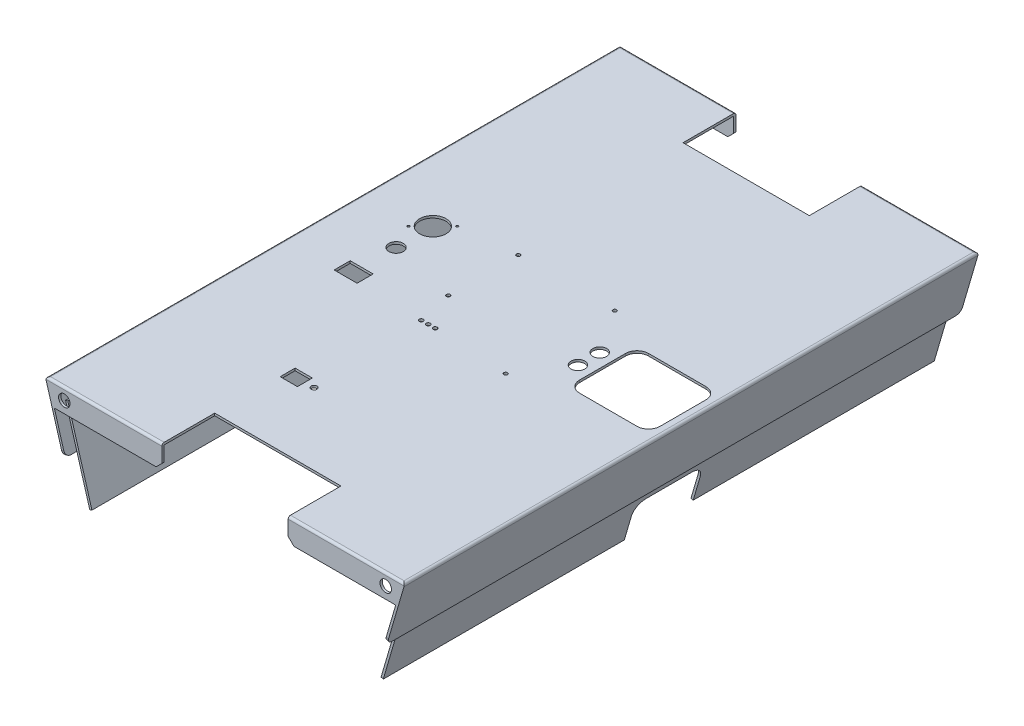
SolidWorks part; units mm, degrees
ref_plane "Plan de face" through (0, 0, 0) normal (0, 0, 1) x (1, 0, 0)
ref_plane "Plan de dessus" through (0, 0, 0) normal (0, 1, 0) x (1, 0, 0)
ref_plane "Plan de droite" through (0, 0, 0) normal (1, 0, 0) x (0, 0, -1)
sketch "Esquisse1" plane through (0, 0, 0) normal (0, 0, 1) x (1, 0, 0)
  line L0 (0, 0) -> (0, 51.9204) construction
  line L1 (-153.9518, 0) -> (153.9518, 0)
  line L2 (155.8714, -2.5612) -> (141, -53.432)
  line L3 (141, -53.432) -> (139.0803, -52.8708)
  line L4 (139.0803, -52.8708) -> (153.9518, -2)
  line L5 (153.9518, -2) -> (-153.9518, -2)
  line L6 (153.9518, 0) -> (175.1069, 0) construction
  line L7 (139.0803, -52.8708) -> (120, -118.139) construction
  line L8 (-139.0803, -52.8708) -> (-153.9518, -2)
  line L9 (-141, -53.432) -> (-139.0803, -52.8708)
  line L10 (-155.8714, -2.5612) -> (-141, -53.432)
  line L11 (155.8714, -2.5612) -> (162.0788, 18.6723) construction
  arc A0 (153.9518, 0) -> (155.8714, -2.5612) centre (153.9518, -2) cw
  arc A1 (-153.9518, 0) -> (-155.8714, -2.5612) centre (-153.9518, -2) ccw
  point P11 (153.7159, -11.4567)
  dimension "D1" = 53
  dimension "D2" = 2
  dimension "D3" = 141
  dimension "D4" = 68
  dimension "D5" = 120
extrude "Extrusion1" add sketch "Esquisse1" along normal blind 500
fillet "Congé1" radius 5 4 edges at (140.0402, -53.1514, 0) (-140.0402, -53.1514, 500) (140.0402, -53.1514, 500) (-140.0402, -53.1514, 0)
sketch "Esquisse2" plane through (-142.3694, -41.6199, 0) normal (0.9598, 0.2806, 0) x (0, 0, -1)
  line L1 (-490, 23.2782) -> (-10, 23.2782)
  line L2 (-490, 23.2782) -> (-490, -51.7218)
  line L3 (-490, -51.7218) -> (-280, -51.7218)
  line L4 (-10, 23.2782) -> (-10, -51.7218)
  line L5 (-250, 43.1978) -> (-250, -160.9671) construction
  line L6 (-500, 43.1978) -> (0, 43.1978) construction
  line L8 (-280, -51.7218) -> (-280, -29.7218)
  line L9 (-270, -19.7218) -> (-230, -19.7218)
  line L10 (-220, -29.7218) -> (-220, -51.7218)
  line L11 (-220, -51.7218) -> (-10, -51.7218)
  line L12 (-495, -11.7218) -> (-5, -11.7218) construction
  arc A0 (-280, -29.7218) -> (-270, -19.7218) centre (-270, -29.7218) cw
  arc A1 (-230, -19.7218) -> (-220, -29.7218) centre (-230, -29.7218) cw
  point P16 (-280, -19.7218)
  point P19 (-220, -19.7218)
  dimension "D6" = 10
  dimension "D1" = 480
  dimension "D2" = 75
  dimension "D3" = 35
  dimension "D4" = 60
  dimension "D5" = 32
extrude "Extrusion2" add sketch "Esquisse2" along normal blind 2
mirror "Symétrie1" about plane through (0, 0, 0) normal (1, 0, 0) of "Extrusion2"
sketch "Esquisse3" plane through (0, 0, 0) normal (0, 1, 0) x (-1, 0, 0)
  line L0 (-153.9518, 250) -> (-67.0313, 250) construction
  line L1 (-153.9518, 500) -> (-153.9518, 0) construction
  line L2 (-155.9518, 500) -> (-155.9518, 0) construction
  line L3 (-138.9518, 220) -> (-88.9518, 220)
  line L4 (-148.9518, 230) -> (-148.9518, 270)
  line L5 (-138.9518, 280) -> (-88.9518, 280)
  line L6 (-78.9518, 230) -> (-78.9518, 270)
  arc A0 (-138.9518, 220) -> (-148.9518, 230) centre (-138.9518, 230) cw
  arc A1 (-88.9518, 220) -> (-78.9518, 230) centre (-88.9518, 230) ccw
  arc A2 (-88.9518, 280) -> (-78.9518, 270) centre (-88.9518, 270) cw
  arc A3 (-148.9518, 270) -> (-138.9518, 280) centre (-138.9518, 270) cw
  dimension "D4" = 10
  dimension "D1" = 60
  dimension "D2" = 70
  dimension "D3" = 7
extrude "Enlèv. mat.-Extru.1" cut sketch "Esquisse3" against normal blind 2
sketch "Esquisse4" plane through (0, 0, 0) normal (0, 0, -1) x (-1, 0, 0)
  line L0 (153.9518, -2) -> (-153.9518, -2) construction
  line L1 (153.9518, -2) -> (-153.9518, -2)
  line L2 (-153.9518, -2) -> (-148.6897, -20)
  line L3 (-153.9518, -2) -> (-140.4833, -48.0717) construction
  line L4 (-148.6897, -20) -> (148.6897, -20)
  line L5 (140.4833, -48.0717) -> (153.9518, -2) construction
  line L6 (148.6897, -20) -> (153.9518, -2)
  dimension "D1" = 18
extrude "Extrusion3" add sketch "Esquisse4" against normal blind 2
sketch "Esquisse6" plane through (0, 0, 0) normal (0, 1, 0) x (-1, 0, 0)
  line L0 (0, 0) -> (0, 332.7909) construction
  line L2 (-55, 0) -> (55, 0)
  line L3 (-55, 0) -> (-55, 46)
  line L4 (-55, 46) -> (55, 46)
  line L5 (55, 0) -> (55, 46)
  line L6 (-153.9518, 0) -> (153.9518, 0) construction
  dimension "D1" = 110
  dimension "D2" = 46
extrude "Enlèv. mat.-Extru.7" cut sketch "Esquisse6" against normal through all
chamfer "Chanfrein1" distance 5 angle 45 2 edges at (-55, -20, 1) (55, -20, 1)
ref_plane "Plan1" through (0, 0, 250) normal (0, 0, 1) x (1, 0, 0)
mirror "Symétrie4" about plane through (0, 0, 250) normal (0, 0, 1) of "Enlèv. mat.-Extru.7", "Chanfrein1", "Extrusion3"
fillet "Congé4" radius 2 3 edges at (-104.4759, 0, 500) (104.4759, 0, 500) (104.4759, 0, 0)
sketch "Esquisse7" plane through (0, 0, 500) normal (0, 0, 1) x (1, 0, 0)
  line L0 (0, 0) -> (0, 55.9274) construction
  line L1 (-153.9518, 0) -> (-55, 0) construction
  circle A0 centre (-140, -10) radius 5
  circle A1 centre (140, -10) radius 5
  dimension "D1" = 10
  dimension "D2" = 10
  dimension "D3" = 280
extrude "Enlèv. mat.-Extru.8" cut sketch "Esquisse7" against normal through all
sketch "Esquisse8" plane through (0, 0, 0) normal (0, 1, 0) x (-1, 0, 0)
  line L0 (153.9518, 250) -> (-78.9518, 250) construction
  line L1 (153.9518, 498) -> (153.9518, 2) construction
  line L2 (-78.9518, 230) -> (-78.9518, 270) construction
  line L3 (155.9518, 0) -> (155.9518, 500) construction
  line L4 (100.9518, 250) -> (100.9518, 268.8047) construction
  line L5 (90.9518, 280) -> (110.9518, 280)
  line L6 (90.9518, 280) -> (90.9518, 294)
  line L7 (90.9518, 294) -> (110.9518, 294)
  line L8 (110.9518, 280) -> (110.9518, 294)
  line L9 (85.7307, 202.7789) -> (121.7448, 238.793) construction
  line L10 (38.9518, 391.5) -> (22.9518, 391.5) construction
  line L11 (38.9518, 385) -> (53.9518, 385)
  line L12 (38.9518, 385) -> (38.9518, 398)
  line L13 (38.9518, 398) -> (53.9518, 398)
  line L14 (53.9518, 385) -> (53.9518, 398)
  circle A0 centre (100.9518, 250) radius 6.25
  circle A1 centre (100.9518, 218) radius 11.5
  circle A2 centre (111.5584, 228.6066) radius 1
  circle A3 centre (90.3452, 207.3934) radius 1
  circle A4 centre (-66.9518, 240.5) radius 6
  circle A5 centre (-66.9518, 259.5) radius 6
  circle A6 centre (30.9518, 391.5) radius 2.5
  dimension "D1" = 12.5
  dimension "D6" = 23
  dimension "D9" = 2
  dimension "D10" = 2
  dimension "D13" = 12
  dimension "D20" = 5
  dimension "D2" = 55
  dimension "D3" = 14
  dimension "D4" = 20
  dimension "D5" = 30
  dimension "D7" = 32
  dimension "D8" = 45
  dimension "D11" = 30
  dimension "D12" = 15
  dimension "D14" = 19
  dimension "D15" = 12
  dimension "D16" = 135
  dimension "D17" = 100
  dimension "D18" = 13
  dimension "D19" = 15
  dimension "D21" = 8
extrude "Enlèv. mat.-Extru.9" cut sketch "Esquisse8" against normal blind 2
sketch "Esquisse9" plane through (0, 0, 0) normal (0, 1, 0) x (-1, 0, 0)
  line L0 (0, 0) -> (0, 503.8585) construction
  line L1 (153.9518, 250) -> (-78.9518, 250) construction
  line L2 (153.9518, 498) -> (153.9518, 2) construction
  line L3 (-78.9518, 230) -> (-78.9518, 270) construction
  line L4 (42, 202.5) -> (42, 287.6114) construction
  line L5 (4.8811, 294) -> (37.9045, 294) construction
  circle A0 centre (-42, 202.5) radius 1.6
  circle A1 centre (-42, 297.5) radius 1.6
  circle A2 centre (42, 202.5) radius 1.6
  circle A3 centre (42, 263.5) radius 1.6
  circle A4 centre (23, 294) radius 1.75
  circle A5 centre (29, 294) radius 1.75
  circle A6 centre (35, 294) radius 1.75
  dimension "D4" = 3.2
  dimension "D5" = 3.5
  dimension "D1" = 84
  dimension "D2" = 95
  dimension "D3" = 61
  dimension "D6" = 6
  dimension "D7" = 6
  dimension "D8" = 44
  dimension "D9" = 7
extrude "Enlèv. mat.-Extru.10" cut sketch "Esquisse9" against normal blind 2
